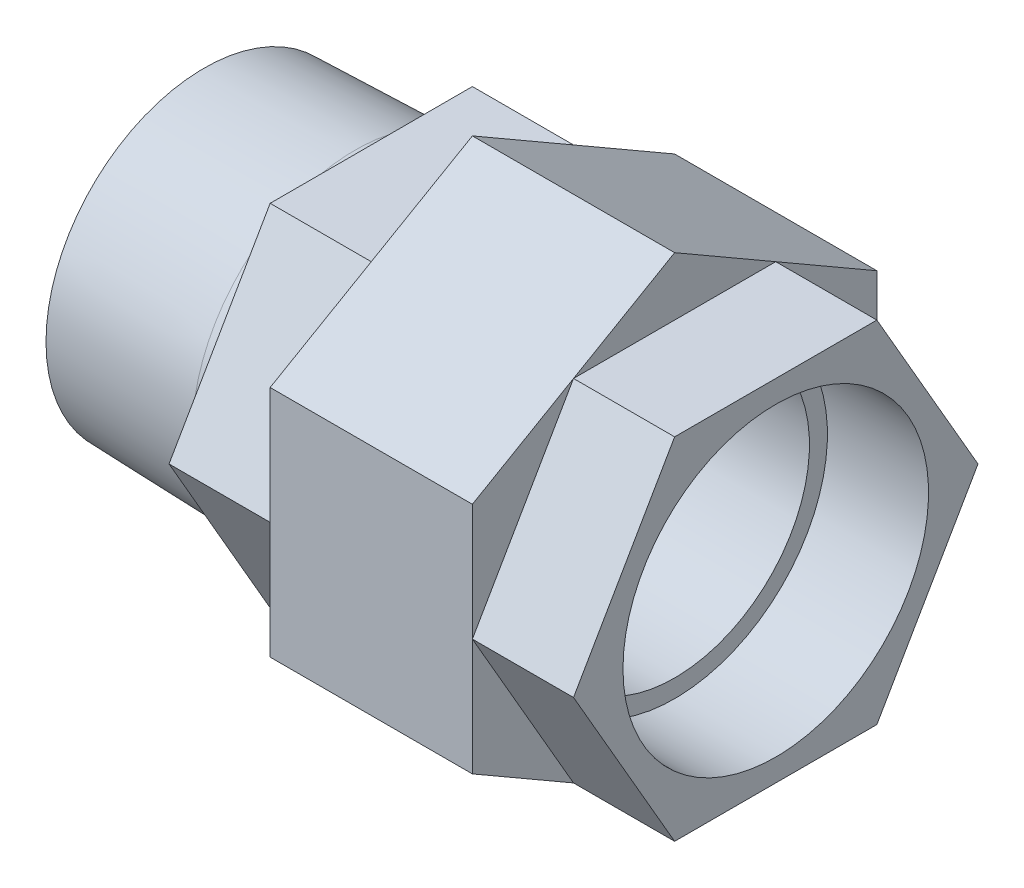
SolidWorks part; units mm, degrees
ref_plane "Face" through (0, 0, 0) normal (0, 0, 1) x (1, 0, 0)
ref_plane "Dessus" through (0, 0, 0) normal (0, 1, 0) x (1, 0, 0)
ref_plane "Droite" through (0, 0, 0) normal (1, 0, 0) x (0, 0, -1)
sketch "Esquisse1" plane through (0, 0, 0) normal (0, 0, 1) x (1, 0, 0)
  line L0 (-65.3489, 0) -> (96.6897, 0) construction
  line L1 (7, 30.15) -> (4, 30.15)
  line L2 (-24, 25) -> (-24, 29.3105)
  line L3 (7, 30.15) -> (7, 30.65)
  line L4 (7, 30.65) -> (25.75, 30.65)
  line L5 (25.75, 30.65) -> (25.75, 37.5)
  line L6 (25.75, 37.5) -> (63.25, 37.5)
  line L7 (63.25, 37.5) -> (63.25, 30.65)
  line L8 (63.25, 30.65) -> (82, 30.65)
  line L9 (82, 30.65) -> (82, 28.3295)
  line L10 (82, 28.3295) -> (58.2, 28.3295)
  line L11 (58.2, 28.3295) -> (58.2, 25)
  line L12 (58.2, 25) -> (-24, 25)
  line L13 (-24, 29.3105) -> (4, 30.15)
  dimension "D2" = 106
  dimension "D3" = 50
  dimension "D4" = 75
  dimension "D5" = 61.3
  dimension "D6" = 56.659
  dimension "D7" = 24
  dimension "D8" = 75
  dimension "D9" = 18.75
  dimension "D10" = 23.8
  dimension "D11" = 60.3
  dimension "D12" = 28
  dimension "D13" = 58.621
revolve "Base-Révolution" add sketch "Esquisse1" angle 360 about L0
sketch "Esquisse2" plane through (25.75, 0, 0) normal (-1, 0, 0) x (0, 0, 1)
  line L1 (37.5, -21.6506) -> (37.5, 21.6506)
  line L2 (37.5, 21.6506) -> (0, 43.3013)
  line L3 (0, 43.3013) -> (-37.5, 21.6506)
  line L4 (-37.5, 21.6506) -> (-37.5, -21.6506)
  line L5 (-37.5, -21.6506) -> (0, -43.3013)
  line L6 (0, -43.3013) -> (37.5, -21.6506)
  circle A0 centre (0, 0) radius 37.5 construction
  circle A1 centre (0, 0) radius 37.5 construction
  circle A2 centre (0, 0) radius 25 construction
  circle A3 centre (0, 0) radius 25
extrude "Boss.-Extru.1" add sketch "Esquisse2" against normal up to surface (37.5 mm away)
sketch "Esquisse3" plane through (7, 0, 0) normal (-1, 0, 0) x (0, 0, 1)
  line L0 (37.5, 21.6506) -> (0, 43.3013) construction
  line L1 (37.5, 0) -> (18.75, 32.476)
  line L2 (18.75, 32.476) -> (-18.75, 32.476)
  line L3 (-18.75, 32.476) -> (-37.5, 0)
  line L4 (-37.5, 0) -> (-18.75, -32.476)
  line L5 (-18.75, -32.476) -> (18.75, -32.476)
  line L6 (18.75, -32.476) -> (37.5, 0)
  circle A0 centre (0, 0) radius 37.5 construction
  circle A3 centre (0, 0) radius 25 construction
  circle A4 centre (0, 0) radius 25
  circle A5 centre (0, 0) radius 29.3105 construction
extrude "Boss.-Extru.2" add sketch "Esquisse3" against normal up to surface (18.75 mm away)
sketch "Esquisse4" plane through (63.25, 0, 0) normal (1, 0, 0) x (0, 0, -1)
  line L0 (37.5, 21.6506) -> (0, 43.3013) construction
  line L1 (18.75, -32.476) -> (37.5, 0)
  line L2 (37.5, 0) -> (18.75, 32.476)
  line L3 (18.75, 32.476) -> (-18.75, 32.476)
  line L4 (-18.75, 32.476) -> (-37.5, 0)
  line L5 (-37.5, 0) -> (-18.75, -32.476)
  line L6 (-18.75, -32.476) -> (18.75, -32.476)
  circle A0 centre (0, 0) radius 37.5 construction
  circle A1 centre (0, 0) radius 25 construction
  circle A2 centre (0, 0) radius 30.65 construction
  circle A3 centre (0, 0) radius 30.65
extrude "Boss.-Extru.3" add sketch "Esquisse4" along normal up to surface (18.75 mm away)
sketch "Esquisse5" plane through (0, 0, 0) normal (0, 0, 1) x (1, 0, 0)
  line L0 (-24, 0) -> (82, 0) construction
  line L1 (82, -28.3295) -> (82, 28.3295) construction
  line L2 (-24, 25) -> (-24, -25) construction
  point P6 (-24, 0)
  point P7 (82, 0)
equation "\"D9@Esquisse1\" = \"D8@Esquisse1\"/4"
equation "\"D2@Représentation de filetage1\" = \"D11@Esquisse1\""
equation "\"D1@Représentation de filetage2\" = \"D12@Esquisse1\""
